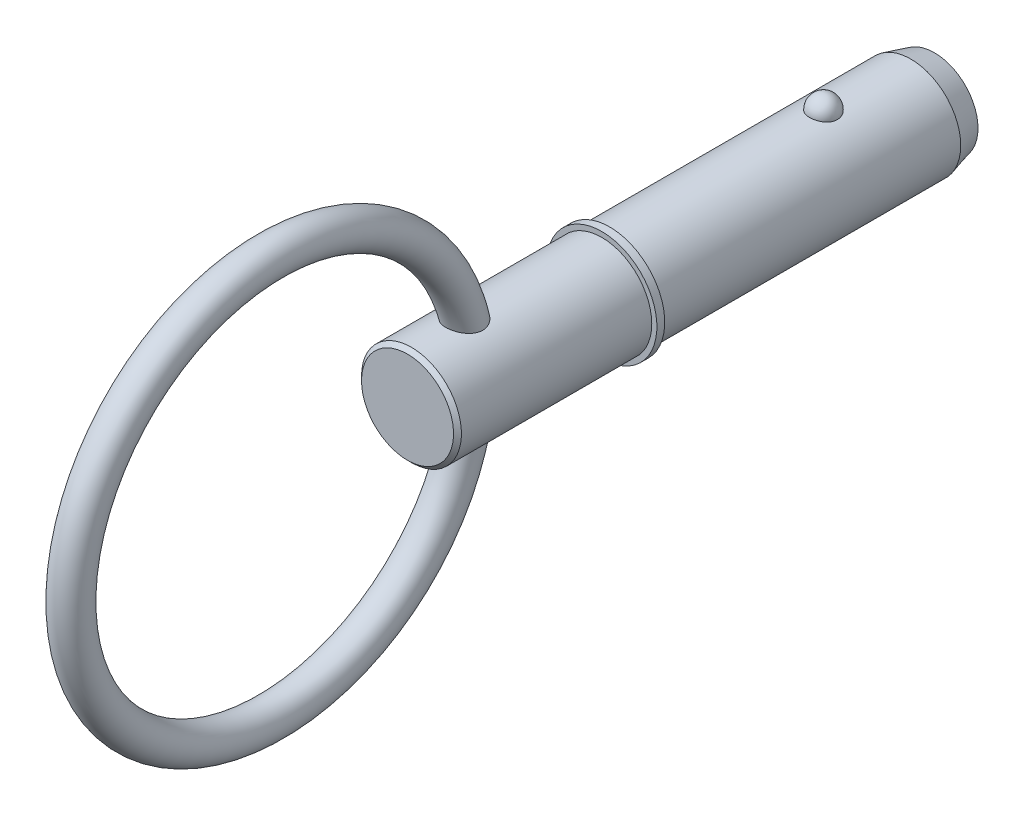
SolidWorks part; units mm, degrees
ref_plane "Front Plane" through (0, 0, 0) normal (0, 0, 1) x (1, 0, 0)
ref_plane "Top Plane" through (0, 0, 0) normal (0, 1, 0) x (1, 0, 0)
ref_plane "Right Plane" through (0, 0, 0) normal (1, 0, 0) x (0, 0, -1)
sketch "Sketch2" plane through (0, 0, 0) normal (0, 0, 1) x (1, 0, 0)
  circle A0 centre (0, 0) radius 6.35
  point P3 (0, 6.35)
  dimension "D1" = 12.7
extrude "Boss-Extrude1" add sketch "Sketch2" along normal blind 25.4
sketch "Sketch3" plane through (0, 0, 0) normal (0, 0, -1) x (-1, 0, 0)
  circle A0 centre (0, 0) radius 6.35
  dimension "D1" = 12.7
extrude "Boss-Extrude2" add sketch "Sketch3" along normal blind 15.88
chamfer "Chamfer1" distance 3 angle 15 1 edges at (-6.35, 0, -15.88)
sketch "Sketch18" plane through (0, 0, 0) normal (1, 0, 0) x (0, 0, -1)
  line L0 (12.88, 6.35) -> (-25.4, 6.35) construction
  line L1 (1.78, 8.13) -> (1.78, 4.57)
  line L2 (-25.4, -6.35) -> (12.88, -6.35) construction
  arc A0 (1.78, 8.13) -> (1.78, 4.57) centre (1.78, 6.35) ccw
  point P4 (0, 6.35)
  dimension "D1" = 14.48
revolve "Revolve1" add sketch "Sketch18" angle 360 about L1
sketch "Sketch19" plane through (0, 0, 0) normal (1, 0, 0) x (0, 0, -1)
  line L0 (-33.7288, 0) -> (-46.4542, 0) construction
sketch "Sketch20" plane through (0, 0, 0) normal (1, 0, 0) x (0, 0, -1)
  line L0 (-25.4, 0) -> (-25.4, 7)
  line L1 (-25.4, 6.35) -> (-25.4, -6.35) construction
  line L2 (-25.4, 7) -> (-26.4, 7)
  line L3 (-26.4, 7) -> (-26.4, 0)
  line L4 (-33.7288, 0) -> (-46.4542, 0) construction
  line L5 (-26.4, 0) -> (-25.4, 0)
  dimension "D1" = 7
  dimension "D2" = 1
revolve "Revolve2" add sketch "Sketch20" angle 360 about L0
sketch "Sketch21" plane through (0, 0, 25.4) normal (0, 0, -1) x (-1, 0, 0)
  circle A0 centre (0, 0) radius 6.35
  dimension "D1" = 12.7
extrude "Boss-Extrude3" add sketch "Sketch21" against normal blind 25.7
chamfer "Chamfer2" distance 0.5 angle 45 1 edges at (-6.35, 0, 51.1)
sketch "Sketch23" plane through (0, 0, 0) normal (1, 0, 0) x (0, 0, -1)
  line L0 (-51.1, 5.85) -> (-51.1, -5.85) construction
  circle A0 centre (-68.5, 0) radius 25.4
  point P2 (-43.1, 0)
  dimension "D1" = 50.8
  dimension "D2" = 8
sketch "Sketch24" plane through (0, 0, 0) normal (0, 1, 0) x (1, 0, 0)
  circle A0 centre (0, -43.1) radius 2.25
  dimension "D1" = 4.5
sweep "Sweep1" add profiles "Sketch24" path "Sketch23"
